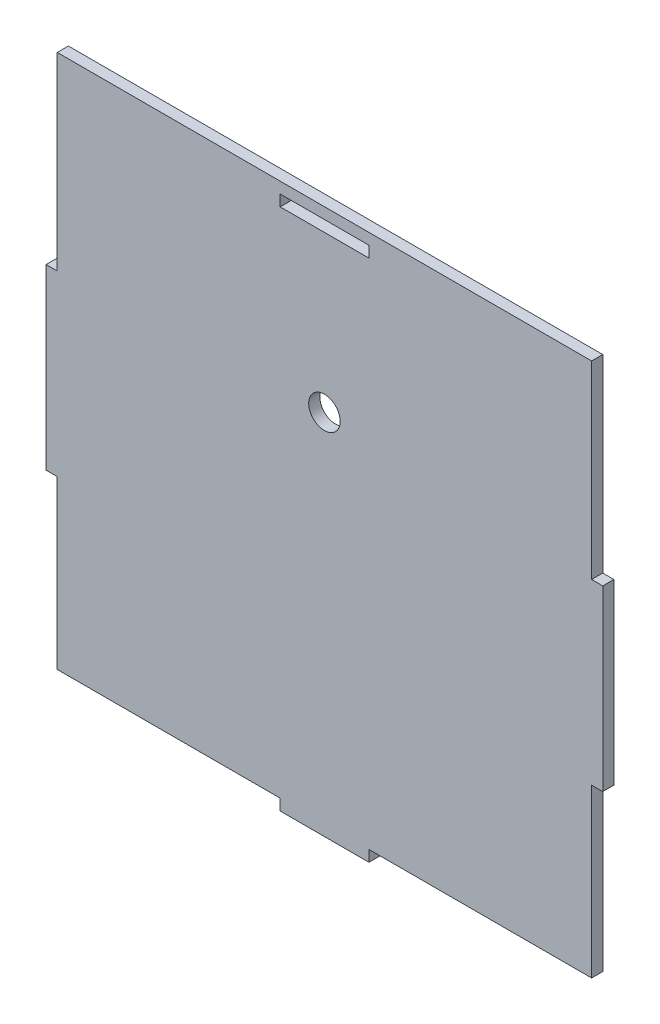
SolidWorks part; units mm, degrees
ref_plane "Front Plane" through (0, 0, 0) normal (0, 0, 1) x (1, 0, 0)
ref_plane "Top Plane" through (0, 0, 0) normal (0, 1, 0) x (1, 0, 0)
ref_plane "Right Plane" through (0, 0, 0) normal (1, 0, 0) x (0, 0, -1)
sketch "Sketch1" plane through (0, 0, 0) normal (0, 0, 1) x (1, 0, 0)
  line L0 (-30.4581, -74.8195) -> (-30.4581, -122.4445)
  line L1 (-30.4581, 29.9555) -> (121.9419, 29.9555)
  line L2 (-30.4581, 29.9555) -> (-30.4581, -24.0195)
  line L3 (-30.4581, -122.4445) -> (33.0419, -122.4445)
  line L4 (121.9419, 29.9555) -> (121.9419, -24.0195)
  line L5 (-30.4581, -24.0195) -> (-33.6331, -24.0195)
  line L6 (58.4419, -122.4445) -> (121.9419, -122.4445)
  line L7 (-30.4581, -74.8195) -> (-33.6331, -74.8195)
  line L8 (-33.6331, -24.0195) -> (-33.6331, -74.8195)
  line L9 (121.9419, -24.0195) -> (125.1169, -24.0195)
  line L11 (121.9419, -74.8195) -> (125.1169, -74.8195)
  line L12 (125.1169, -24.0195) -> (125.1169, -74.8195)
  line L13 (121.9419, -74.8195) -> (121.9419, -122.4445)
  line L14 (33.0419, -122.4445) -> (33.0419, -125.6195)
  line L15 (33.0419, -125.6195) -> (58.4419, -125.6195)
  line L16 (58.4419, -122.4445) -> (58.4419, -125.6195)
  line L17 (33.1214, 26.7805) -> (58.5214, 26.7805)
  line L18 (33.1214, 26.7805) -> (33.1214, 23.6055)
  line L19 (33.1214, 23.6055) -> (58.5214, 23.6055)
  line L20 (58.5214, 26.7805) -> (58.5214, 23.6055)
  circle A0 centre (45.7419, -20.8445) radius 4.4901
  dimension "D16" = 50.8
  dimension "D18" = 8.9803
  dimension "D1" = 152.4
  dimension "D2" = 152.4
  dimension "D3" = 3.175
  dimension "D4" = 3.175
  dimension "D5" = 3.175
  dimension "D6" = 3.175
  dimension "D7" = 50.8
  dimension "D8" = 25.4
  dimension "D9" = 50.8
  dimension "D10" = 25.4
  dimension "D11" = 3.175
  dimension "D12" = 63.5
  dimension "D13" = 47.625
  dimension "D14" = 47.625
  dimension "D15" = 63.5
  dimension "D17" = 76.2
extrude "Boss-Extrude1" add sketch "Sketch1" along normal blind 3.175
